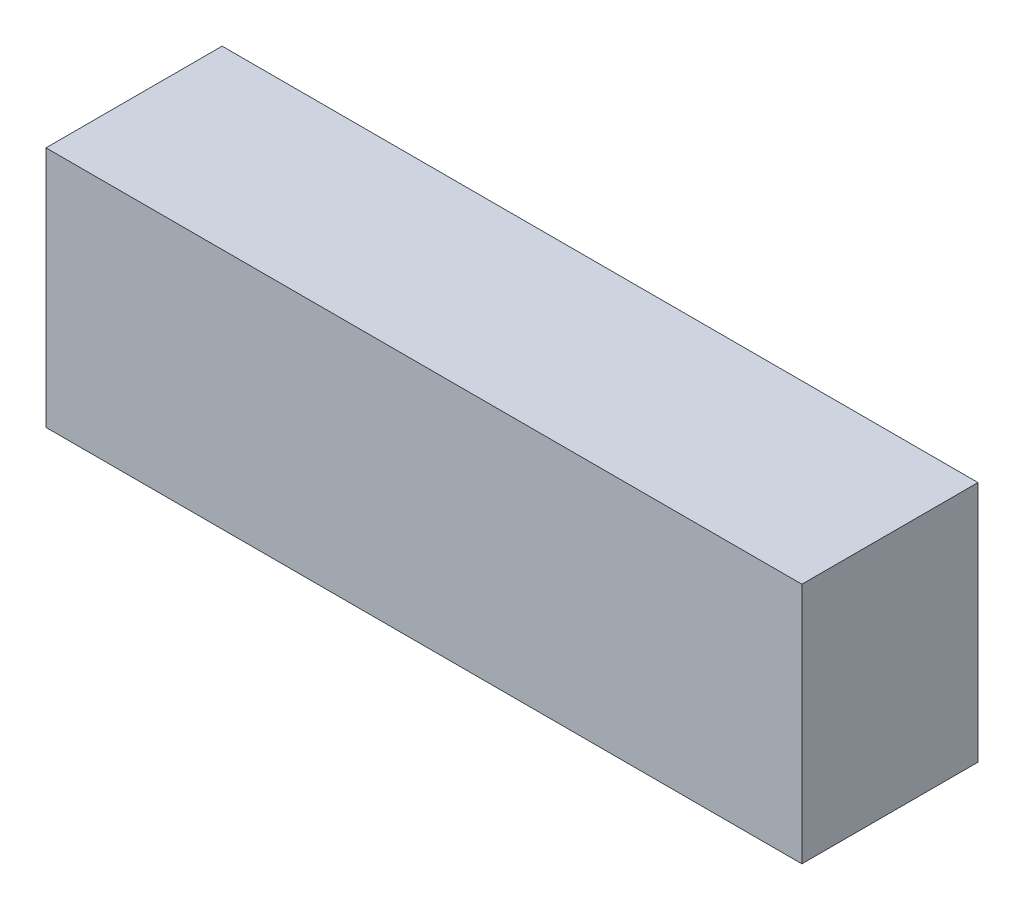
SolidWorks part; units mm, degrees
ref_plane "Front Plane" through (0, 0, 0) normal (0, 0, 1) x (1, 0, 0)
ref_plane "Top Plane" through (0, 0, 0) normal (0, 1, 0) x (1, 0, 0)
ref_plane "Right Plane" through (0, 0, 0) normal (1, 0, 0) x (0, 0, -1)
sketch "Sketch1" plane through (0, 0, 0) normal (0, 0, 1) x (1, 0, 0)
  line L1 (-48.7481, 22.5067) -> (54.2519, 22.5067)
  line L2 (-48.7481, 22.5067) -> (-48.7481, -10.4933)
  line L3 (-48.7481, -10.4933) -> (54.2519, -10.4933)
  line L4 (54.2519, 22.5067) -> (54.2519, -10.4933)
  dimension "D1" = 103
  dimension "D2" = 33
extrude "Boss-Extrude1" add sketch "Sketch1" along normal blind 24
sketch "Sketch2" plane through (0, 0, 24) normal (0, 0, 1) x (1, 0, 0)
  text T0 "11.1 V Battery"
